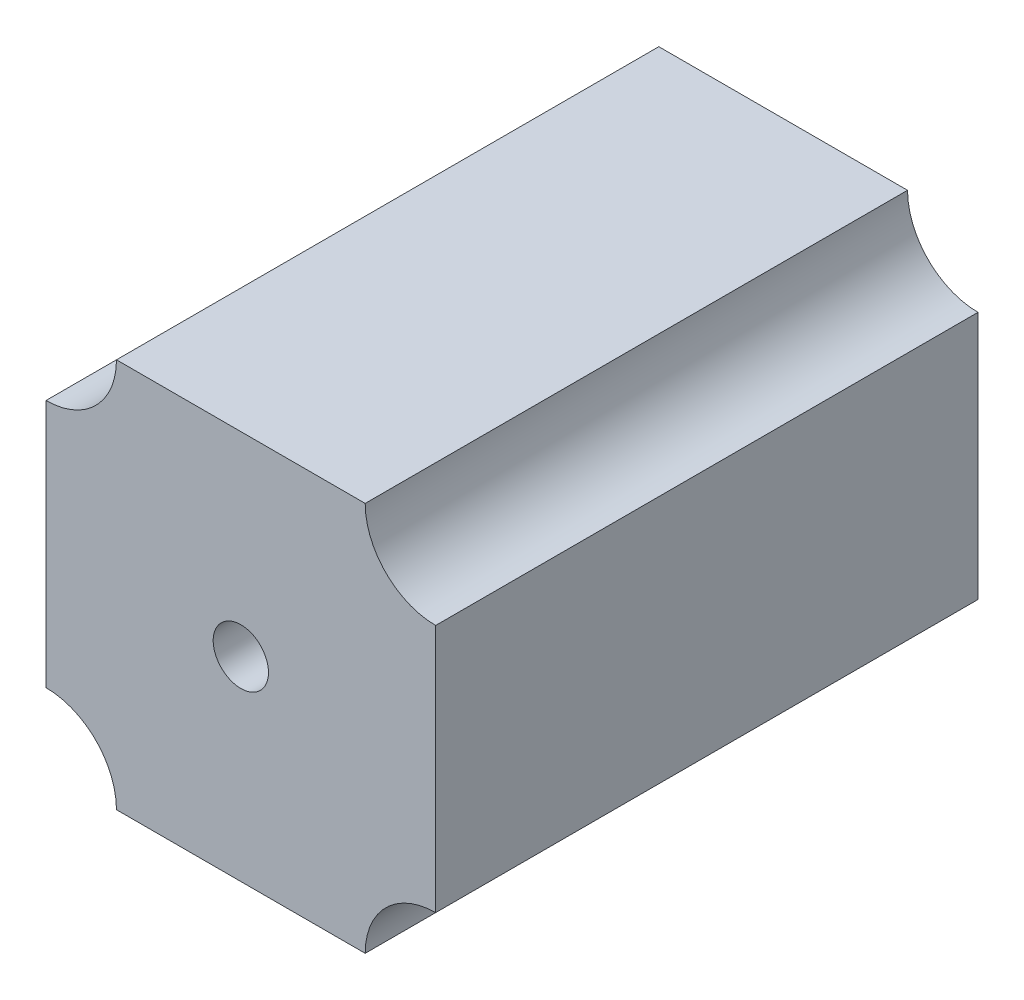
SolidWorks part; units mm, degrees
ref_plane "前视" through (0, 0, 0) normal (0, 0, 1) x (1, 0, 0)
ref_plane "上视" through (0, 0, 0) normal (0, 1, 0) x (1, 0, 0)
ref_plane "右视" through (0, 0, 0) normal (1, 0, 0) x (0, 0, -1)
sketch "草图1" plane through (0, 0, 0) normal (0, 0, 1) x (1, 0, 0)
  line L1 (18, -28.2) -> (-18, -28.2)
  line L2 (28.2, -18) -> (28.2, 18)
  line L3 (18, 28.2) -> (-18, 28.2)
  line L4 (-28.2, -18) -> (-28.2, 18)
  line L5 (28.2, -28.2) -> (-28.2, 28.2) construction
  line L6 (28.2, 28.2) -> (-28.2, -28.2) construction
  line L11 (28.2, -18) -> (-28.2, 18) construction
  line L12 (28.2, 18) -> (-28.2, -18) construction
  line L17 (18, -28.2) -> (-18, 28.2) construction
  line L18 (18, 28.2) -> (-18, -28.2) construction
  arc A0 (-28.2, 18) -> (-18, 28.2) centre (-28.2, 28.2) ccw
  arc A1 (18, 28.2) -> (28.2, 18) centre (28.2, 28.2) ccw
  arc A2 (18, -28.2) -> (28.2, -18) centre (28.2, -28.2) cw
  arc A3 (-28.2, -18) -> (-18, -28.2) centre (-28.2, -28.2) cw
  point P0 (0, 0)
  point P6 (0, 0)
  point P11 (0, 0)
  dimension "D1" = 56.4
  dimension "D2" = 56.4
  dimension "D3" = 36
  dimension "D4" = 36
extrude "凸台-拉伸1" add sketch "草图1" along normal blind 78.5
sketch "草图2" plane through (0, 0, 78.5) normal (0, 0, 1) x (1, 0, 0)
  circle A0 centre (0, 0) radius 4
extrude "切除-拉伸1" cut sketch "草图2" against normal blind 78.5
